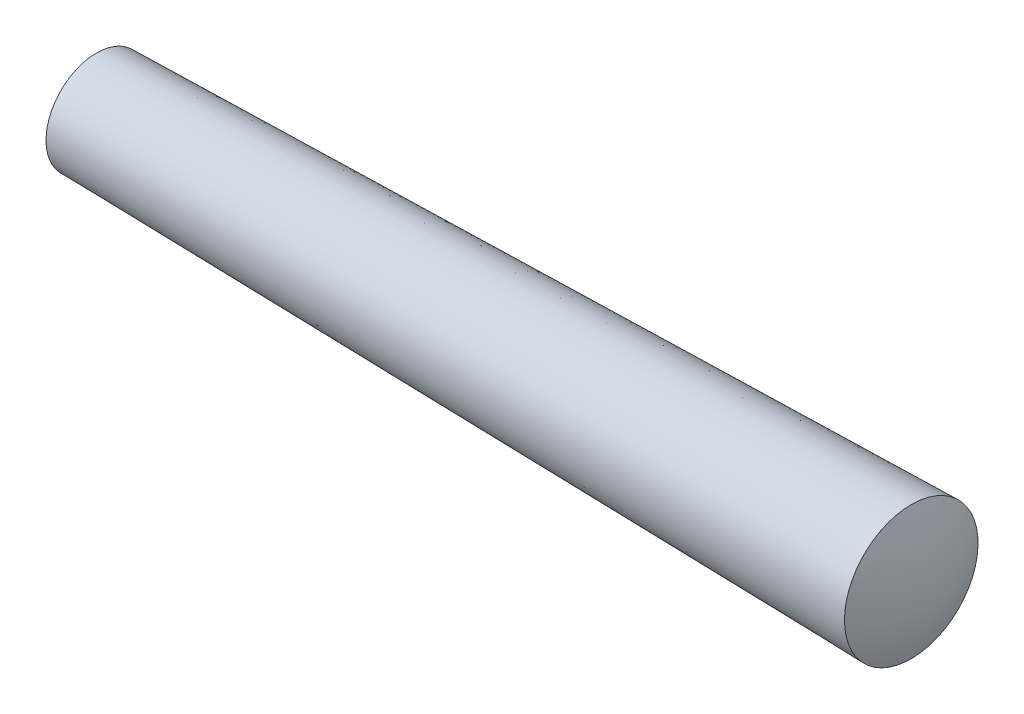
SolidWorks part; units mm, degrees
ref_plane "Front" through (0, 0, 0) normal (0, 0, 1) x (1, 0, 0)
ref_plane "Top" through (0, 0, 0) normal (0, 1, 0) x (1, 0, 0)
ref_plane "Right" through (0, 0, 0) normal (1, 0, 0) x (0, 0, -1)
sketch "Sketch1" plane through (0, 0, 0) normal (0, 0, 1) x (1, 0, 0)
  line L0 (0, 0) -> (5, 0)
  line L1 (0.08, 0.3) -> (4.92, 0.3) construction
  line L2 (4.92, 0.3) -> (4.92, 0.3968) construction
  line L3 (0.08, 0.3) -> (4.92, 0.3968)
  line L4 (-4.0035, 0) -> (8.3584, 0) construction
  line L5 (5, 0) -> (5, -0.7875) construction
  line L6 (0, 0) -> (0, -0.8153) construction
  arc A0 (0.08, 0.3) -> (0, 0) centre (0.6025, 0) ccw
  arc A1 (5, 0) -> (4.92, 0.3968) centre (3.9759, 0) ccw
  dimension "l" = 5
  dimension "D5" = 0.0968
  dimension "a" = 0.08
  dimension "d" = 0.6
  dimension "a1" = 0.08
revolve "Base-Revolve" add sketch "Sketch1" angle 360 about L4
equation "\"D5@Sketch1\" = ( \"l@Sketch1\"-2*\"a@Sketch1\")/ 50"
equation "\"a1@Sketch1\" = \"a@Sketch1\""
